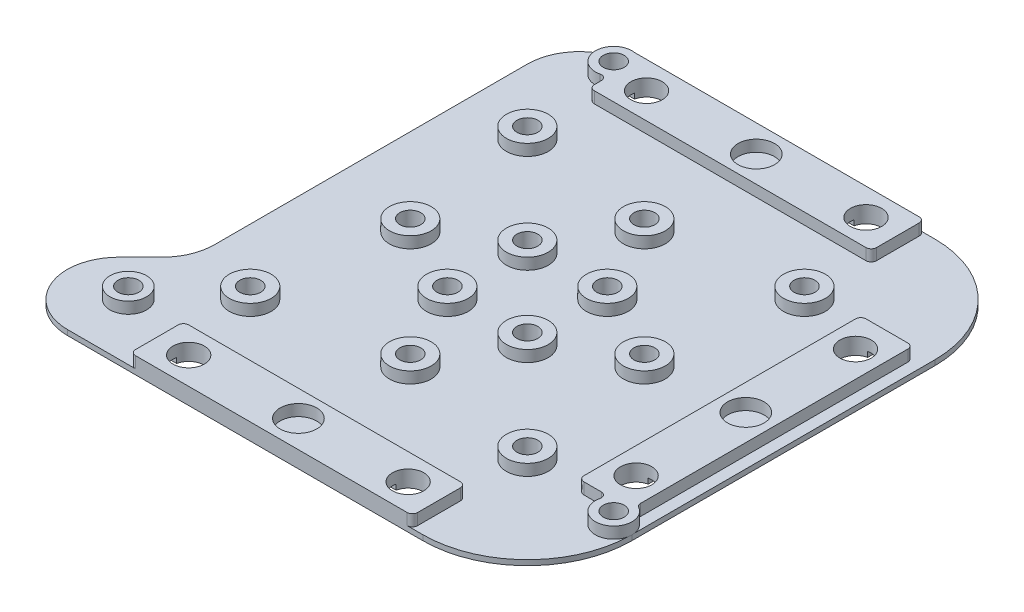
SolidWorks part; units mm, degrees
ref_plane "Front Plane" through (0, 0, 0) normal (0, 0, 1) x (1, 0, 0)
ref_plane "Top Plane" through (0, 0, 0) normal (0, 1, 0) x (1, 0, 0)
ref_plane "Right Plane" through (0, 0, 0) normal (1, 0, 0) x (0, 0, -1)
sketch "Sketch1" plane through (0, 0, 0) normal (0, 1, 0) x (1, 0, 0)
  line L1 (-49, -49) -> (49, -49)
  line L2 (-49, -49) -> (-49, 49)
  line L3 (-49, 49) -> (49, 49)
  line L4 (49, -49) -> (49, 49)
  line L5 (-49, -49) -> (49, 49) construction
  line L6 (-49, 49) -> (49, -49) construction
  point P0 (0, 0)
  dimension "D1" = 98
  dimension "D2" = 98
extrude "Boss-Extrude1" add sketch "Sketch1" along normal blind 1
sketch "Sketch2" plane through (0, 1, 0) normal (0, 1, 0) x (1, 0, 0)
  line L0 (0, 0) -> (49, 0) construction
  line L1 (49, -49) -> (49, 49) construction
  line L2 (0, 0) -> (7.6509, 7.6509) construction
  line L3 (0, 0) -> (0, 22.4) construction
  line L4 (0, 0) -> (-26.5165, 26.5165) construction
  circle A0 centre (7.6509, 7.6509) radius 2.0025
  circle A1 centre (0, 22.4) radius 2.0025
  circle A2 centre (-26.5165, 26.5165) radius 2.0025
  dimension "D4" = 4.005
  dimension "D1" = 45
  dimension "D2" = 45
  dimension "D3" = 45
  dimension "D5" = 10.82
  dimension "D6" = 22.4
  dimension "D7" = 37.5
extrude "Cut-Extrude1" cut sketch "Sketch2" against normal up to next
sketch "Sketch3" plane through (0, 0, 0) normal (0, 0, 1) x (1, 0, 0)
  line L0 (0, 0) -> (0, 1) construction
  line L1 (-49, 0) -> (49, 0) construction
  line L2 (-49, 1) -> (49, 1) construction
pattern_circular "CirPattern1" count 4 over 360 about axis through (0, 0, 0) along (0, 1, 0) of "Cut-Extrude1"
sketch "Sketch4" plane through (0, 1, 0) normal (0, 1, 0) x (1, 0, 0)
  circle A0 centre (-26.5165, 26.5165) radius 2.0025 construction
  circle A1 centre (0, 22.4) radius 2.0025 construction
  circle A2 centre (26.5165, 26.5165) radius 2.0025 construction
  circle A3 centre (-7.6509, 7.6509) radius 2.0025 construction
  circle A4 centre (7.6509, 7.6509) radius 2.0025 construction
  circle A5 centre (-22.4, 0) radius 2.0025 construction
  circle A6 centre (-7.6509, -7.6509) radius 2.0025 construction
  circle A7 centre (7.6509, -7.6509) radius 2.0025 construction
  circle A8 centre (22.4, 0) radius 2.0025 construction
  circle A9 centre (-26.5165, -26.5165) radius 2.0025 construction
  circle A10 centre (0, -22.4) radius 2.0025 construction
  circle A11 centre (26.5165, -26.5165) radius 2.0025 construction
  circle A12 centre (-26.5165, 26.5165) radius 2.0025
  circle A13 centre (0, 22.4) radius 2.0025
  circle A14 centre (26.5165, 26.5165) radius 2.0025
  circle A15 centre (-7.6509, 7.6509) radius 2.0025
  circle A16 centre (7.6509, 7.6509) radius 2.0025
  circle A17 centre (-22.4, 0) radius 2.0025
  circle A18 centre (-7.6509, -7.6509) radius 2.0025
  circle A19 centre (7.6509, -7.6509) radius 2.0025
  circle A20 centre (22.4, 0) radius 2.0025
  circle A21 centre (-26.5165, -26.5165) radius 2.0025
  circle A22 centre (0, -22.4) radius 2.0025
  circle A23 centre (26.5165, -26.5165) radius 2.0025
  circle A24 centre (-26.5165, 26.5165) radius 4.0025
  circle A25 centre (0, 22.4) radius 4.0025
  circle A26 centre (26.5165, 26.5165) radius 4.0025
  circle A27 centre (-7.6509, 7.6509) radius 4.0025
  circle A28 centre (7.6509, 7.6509) radius 4.0025
  circle A29 centre (-22.4, 0) radius 4.0025
  circle A30 centre (-7.6509, -7.6509) radius 4.0025
  circle A31 centre (7.6509, -7.6509) radius 4.0025
  circle A32 centre (22.4, 0) radius 4.0025
  circle A33 centre (-26.5165, -26.5165) radius 4.0025
  circle A34 centre (0, -22.4) radius 4.0025
  circle A35 centre (26.5165, -26.5165) radius 4.0025
  dimension "D1" = 2
extrude "Boss-Extrude2" add sketch "Sketch4" along normal blind 2.175
sketch "Sketch5" plane through (0, 1, 0) normal (0, 1, 0) x (1, 0, 0)
  line L0 (0, 0) -> (0, 49) construction
  line L1 (49, 49) -> (-49, 49) construction
  line L2 (0, 0) -> (49, 0) construction
  line L3 (49, -49) -> (49, 49) construction
  line L4 (0, 0) -> (0, -49) construction
  line L5 (-49, -49) -> (49, -49) construction
  circle A0 centre (0, -43.814) radius 5
  circle A1 centre (0, -43.814) radius 3.5
  circle A2 centre (41.815, 0) radius 5
  circle A3 centre (41.815, 0) radius 3.5
  circle A4 centre (0, 43.814) radius 5
  circle A5 centre (0, 43.814) radius 3.5
  dimension "D1" = 7
  dimension "D2" = 1.5
  dimension "D3" = 43.814
  dimension "D4" = 43.814
  dimension "D5" = 41.815
sketch "Sketch7" plane through (0, 1, 0) normal (0, 1, 0) x (1, 0, 0)
  circle A0 centre (21, 43.814) radius 3
  circle A1 centre (-21, 43.814) radius 3
  circle A2 centre (41.815, 21) radius 3
  circle A3 centre (41.815, -21) radius 3
  circle A4 centre (21, -43.814) radius 3
  circle A5 centre (-21, -43.814) radius 3
sketch "Sketch9" plane through (0, 1, 0) normal (0, 1, 0) x (1, 0, 0)
  line L0 (-38.1838, -38.1838) -> (0, 0) construction
  line L1 (0, 0) -> (-29.0142, 45.5431) construction
  line L2 (0, 0) -> (45.5431, -29.0142) construction
  line L3 (-29.0142, 45.5431) -> (-38.1838, -38.1838) construction
  line L4 (-38.1838, -38.1838) -> (45.5431, -29.0142) construction
  circle A0 centre (-38.1838, -38.1838) radius 2
  circle A1 centre (-29.0142, 45.5431) radius 2
  circle A2 centre (45.5431, -29.0142) radius 2
  dimension "D4" = 4
  dimension "D1" = 54
  dimension "D2" = 102.5
extrude "Cut-Extrude4" cut sketch "Sketch9" against normal up to next
sketch "Sketch10" plane through (0, 1, 0) normal (0, 1, 0) x (1, 0, 0)
  circle A0 centre (-38.1838, -38.1838) radius 3.5
  circle A1 centre (-29.0142, 45.5431) radius 3.5
  circle A2 centre (45.5431, -29.0142) radius 3.5
  circle A3 centre (-29.0142, 45.5431) radius 2 construction
  circle A4 centre (-38.1838, -38.1838) radius 2 construction
  circle A5 centre (45.5431, -29.0142) radius 2 construction
  circle A6 centre (-29.0142, 45.5431) radius 2
  circle A7 centre (-38.1838, -38.1838) radius 2
  circle A8 centre (45.5431, -29.0142) radius 2
  dimension "D1" = 7
sketch "Sketch11" plane through (0, 1, 0) normal (0, 1, 0) x (1, 0, 0)
  line L0 (-49, 49) -> (-49, -49) construction
  line L1 (-49, 49) -> (-39, 49)
  line L2 (-49, 49) -> (-49, -25)
  line L3 (-49, -25) -> (-39, -25)
  line L4 (-39, 49) -> (-39, -25)
  line L5 (0, 0) -> (-49, 0) construction
  line L6 (49, 49) -> (-49, 49) construction
  dimension "D1" = 10
  dimension "D2" = 25
extrude "Cut-Extrude5" cut sketch "Sketch11" against normal up to next
chamfer "Chamfer1" distance 10 angle 45 1 edges at (-49, 0.5, 25)
fillet "Fillet1" radius 10 4 edges at (-39, 0.5, 25) (-49, 0.5, 35) (-39, 0.5, -49) (-49, 0.5, 49)
extrude "Boss-Extrude4" add sketch "Sketch10" along normal blind 2.18
extrude "Cut-Extrude7" cut sketch "Sketch7" against normal blind 2.18
sketch "Sketch15" plane through (0, 1, 0) normal (0, 1, 0) x (1, 0, 0)
  line L0 (41.815, 0) -> (36.815, 0)
  line L1 (36.815, 0) -> (41.815, 0)
  line L2 (36.815, 0) -> (36.815, -27)
  line L3 (36.815, -27) -> (36.815, 0)
  line L4 (36.815, -27) -> (42.6808, -27)
  line L5 (42.6808, -27) -> (36.815, -27)
  line L6 (41.815, 0) -> (46.815, 0)
  line L7 (46.815, 0) -> (41.815, 0)
  line L8 (46.815, 0) -> (46.815, -25.7534)
  line L9 (46.815, -25.7534) -> (46.815, 0)
  line L10 (46.815, 0) -> (46.815, 27)
  line L11 (46.815, 27) -> (46.815, 0)
  line L12 (46.815, 27) -> (36.815, 27)
  line L13 (36.815, 27) -> (36.815, 0)
  line L14 (36.815, 0) -> (36.5821, 0.0898)
  line L15 (0, 43.814) -> (0, 38.814)
  line L16 (0, 38.814) -> (0, 43.814)
  line L17 (0, 38.814) -> (27, 38.814)
  line L18 (27, 38.814) -> (0, 38.814)
  line L19 (27, 38.814) -> (27, 49)
  line L20 (49, 49) -> (-28.4664, 49) construction
  line L21 (0, 38.814) -> (-27, 38.814)
  line L22 (-27, 38.814) -> (0, 38.814)
  line L23 (-27, 38.814) -> (-27, 42.6808)
  line L24 (-28.4664, 49) -> (27, 49)
  line L25 (0, -43.814) -> (0, -38.814)
  line L26 (0, -38.814) -> (0, -43.814)
  line L27 (0, -38.814) -> (27, -38.814)
  line L28 (27, -38.814) -> (0, -38.814)
  line L29 (27, -38.814) -> (27, -49)
  line L30 (-39, -49) -> (49, -49) construction
  line L31 (0, -38.814) -> (-27, -38.814)
  line L32 (-27, -38.814) -> (0, -38.814)
  line L33 (-27, -38.814) -> (-27, -49)
  line L34 (-27, -49) -> (27, -49)
  arc A0 (49, -28.4664) -> (49, -29.562) centre (45.5431, -29.0142) ccw construction
  arc A1 (-29.6986, 48.9756) -> (-28.4664, 49) centre (-29.0142, 45.5431) ccw construction
  circle A2 centre (-29.0142, 45.5431) radius 3.5
  circle A3 centre (45.5431, -29.0142) radius 3.5
  point P0 (-29.0142, 45.5431)
fillet "Fillet2" [suppressed] radius 10
fillet "Fillet3" radius 20 2 edges at (49, 0.5, 49) (49, 0.5, -49)
extrude "Boss-Extrude10" add sketch "Sketch15" along normal through all
extrude "Cut-Extrude10" cut sketch "Sketch5" along normal blind 9.5 contours A1 | A5 | A3
fillet "Fillet4" radius 1 13 edges at (27, 2.09, -38.814) (27, 2.09, -49) (-27, 2.09, -38.814) (-27, 2.09, -42.6808) (46.815, 2.09, -27) (36.815, 2.09, -27) (46.815, 2.09, 25.7534) (42.6808, 2.09, 27) (36.815, 2.09, 27) (27, 2.09, 38.814) (27, 2.09, 49) (-27, 2.09, 38.814) (-27, 2.09, 49)
sketch "Sketch16" plane through (0, 0, 0) normal (0, -1, 0) x (-1, 0, 0)
  line L0 (-26, 43.814) -> (-16, 43.814) construction
  line L1 (-26, 44.439) -> (-16, 44.439)
  line L2 (-26, 43.189) -> (-16, 43.189)
  line L3 (16, 43.814) -> (26, 43.814) construction
  line L4 (16, 44.439) -> (26, 44.439)
  line L5 (16, 43.189) -> (26, 43.189)
  line L6 (-41.815, 26) -> (-41.815, 16) construction
  line L7 (-41.19, 26) -> (-41.19, 16)
  line L8 (-42.44, 26) -> (-42.44, 16)
  line L9 (-41.815, -26) -> (-41.815, -16) construction
  line L10 (-42.44, -26) -> (-42.44, -16)
  line L11 (-41.19, -26) -> (-41.19, -16)
  line L12 (-26, -43.814) -> (-16, -43.814) construction
  line L13 (-26, -43.189) -> (-16, -43.189)
  line L14 (-26, -44.439) -> (-16, -44.439)
  line L15 (16, -43.814) -> (26, -43.814) construction
  line L16 (16, -43.189) -> (26, -43.189)
  line L17 (16, -44.439) -> (26, -44.439)
  arc A0 (-26, 44.439) -> (-26, 43.189) centre (-26, 43.814) ccw
  arc A1 (-16, 43.189) -> (-16, 44.439) centre (-16, 43.814) ccw
  arc A2 (16, 44.439) -> (16, 43.189) centre (16, 43.814) ccw
  arc A3 (26, 43.189) -> (26, 44.439) centre (26, 43.814) ccw
  arc A4 (-41.19, 26) -> (-42.44, 26) centre (-41.815, 26) ccw
  arc A5 (-42.44, 16) -> (-41.19, 16) centre (-41.815, 16) ccw
  arc A6 (-42.44, -26) -> (-41.19, -26) centre (-41.815, -26) ccw
  arc A7 (-41.19, -16) -> (-42.44, -16) centre (-41.815, -16) ccw
  arc A8 (-26, -43.189) -> (-26, -44.439) centre (-26, -43.814) ccw
  arc A9 (-16, -44.439) -> (-16, -43.189) centre (-16, -43.814) ccw
  arc A10 (16, -43.189) -> (16, -44.439) centre (16, -43.814) ccw
  arc A11 (26, -44.439) -> (26, -43.189) centre (26, -43.814) ccw
  point P2 (-21, 43.814)
  point P10 (21, 43.814)
  point P18 (-41.815, 21)
  point P26 (-41.815, -21)
  point P34 (-21, -43.814)
  point P42 (21, -43.814)
extrude "Cut-Extrude11" cut sketch "Sketch16" against normal blind 1
sketch "Sketch17" plane through (0, 1, 0) normal (0, 1, 0) x (1, 0, 0)
  line L0 (0, -43.814) -> (41.815, 0) construction
  line L1 (41.815, 0) -> (0, 43.814) construction
